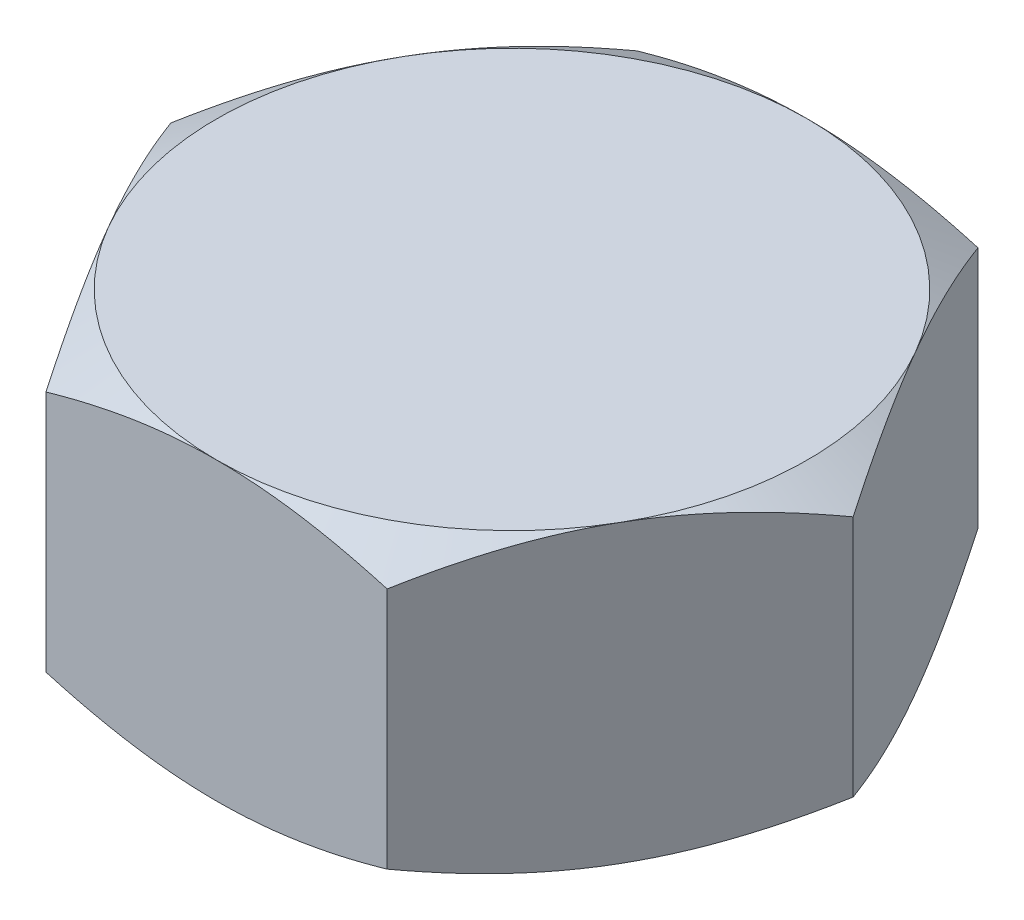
SolidWorks part; units mm, degrees
ref_plane "Plan de face" through (0, 0, 0) normal (0, 0, 1) x (1, 0, 0)
ref_plane "Plan de dessus" through (0, 0, 0) normal (0, 1, 0) x (1, 0, 0)
ref_plane "Plan de droite" through (0, 0, 0) normal (1, 0, 0) x (0, 0, -1)
sketch "Esquisse1" plane through (0, 0, 0) normal (0, 1, 0) x (1, 0, 0)
  line L1 (5.7735, 0) -> (2.8868, 5)
  line L2 (2.8868, 5) -> (-2.8868, 5)
  line L3 (-2.8868, 5) -> (-5.7735, 0)
  line L4 (-5.7735, 0) -> (-2.8868, -5)
  line L5 (-2.8868, -5) -> (2.8868, -5)
  line L6 (2.8868, -5) -> (5.7735, 0)
  circle A0 centre (0, 0) radius 5 construction
  dimension "D1" = 10
extrude "Extrusion1" add sketch "Esquisse1" along normal mid plane 5
sketch "Esquisse2" plane through (0, 0, 0) normal (1, 0, 0) x (0, 0, -1)
  line L0 (2, 4.2321) -> (8, 4.2321)
  line L1 (8, 4.2321) -> (8, 0.7679)
  line L2 (8, 0.7679) -> (2, 4.2321)
  line L3 (0, 9.378) -> (0, -1.3286) construction
  dimension "D1" = 30
  dimension "D2" = 3
revolve "Enlèvement de matière-Révolution4" cut sketch "Esquisse2" angle 360 about L3
mirror "Symétrie1" about plane through (0, 0, 0) normal (0, 1, 0) of "Enlèvement de matière-Révolution4"
